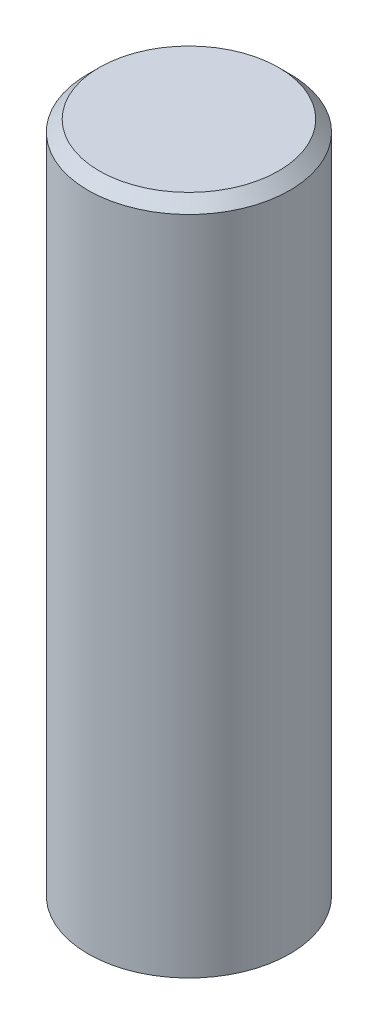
SolidWorks part; units mm, degrees
ref_plane "Front" through (0, 0, 0) normal (0, 0, 1) x (1, 0, 0)
ref_plane "Top" through (0, 0, 0) normal (0, 1, 0) x (1, 0, 0)
ref_plane "Right" through (0, 0, 0) normal (1, 0, 0) x (0, 0, -1)
sketch "Sketch1" plane through (0, 0, 0) normal (0, 1, 0) x (1, 0, 0)
  circle A0 centre (0, 0) radius 9
  dimension "D1" = 18
extrude "Boss-Extrude1" add sketch "Sketch1" along normal blind 60
chamfer "Chamfer1" distance 1 angle 45 1 edges at (0, 60, 9)
